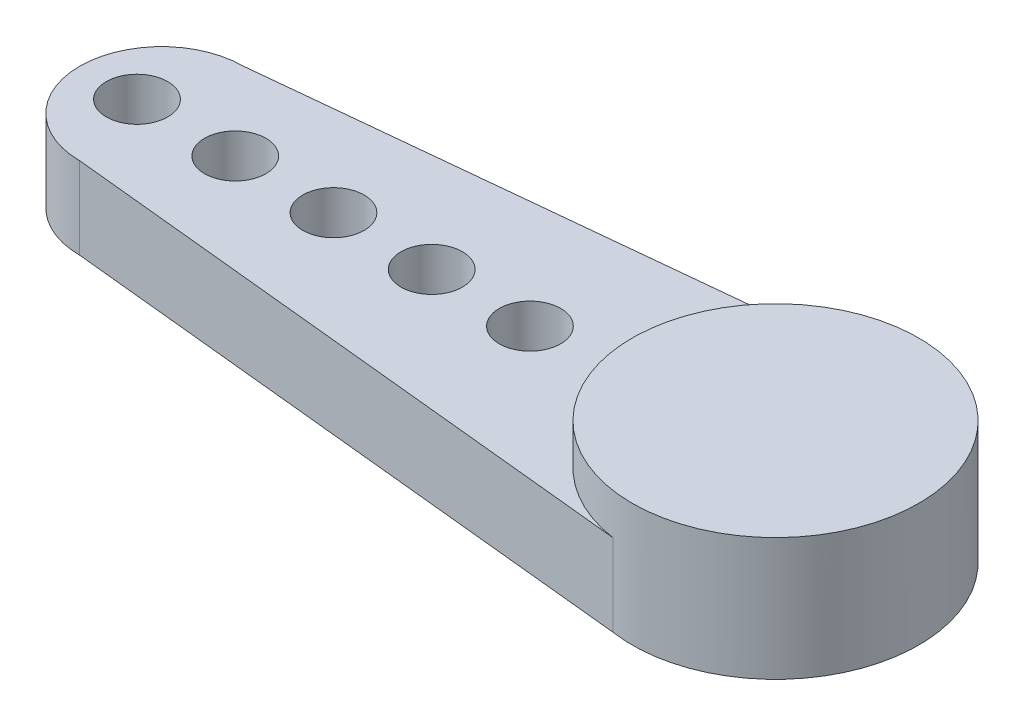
SolidWorks part; units mm, degrees
ref_plane "Front Plane" through (0, 0, 0) normal (0, 0, 1) x (1, 0, 0)
ref_plane "Top Plane" through (0, 0, 0) normal (0, 1, 0) x (1, 0, 0)
ref_plane "Right Plane" through (0, 0, 0) normal (1, 0, 0) x (0, 0, -1)
sketch "Sketch1" plane through (0, 0, 0) normal (0, 1, 0) x (1, 0, 0)
  line L0 (-15, 2) -> (-0.5089, 3.4628)
  line L1 (-15, -2) -> (-0.5089, -3.4628)
  arc A0 (-0.5089, -3.4628) -> (-0.5089, 3.4628) centre (0, 0) ccw
  arc A1 (-15, 2) -> (-15, -2) centre (-15, 0) ccw
  circle A2 centre (-6, 0) radius 0.75
  circle A3 centre (-8.4, 0) radius 0.75
  circle A4 centre (-10.8, 0) radius 0.75
  circle A5 centre (-13.2, 0) radius 0.75
  circle A6 centre (-15.6, 0) radius 0.75
  point P17 (-17, 0)
  point P18 (-17, 0)
  dimension "D1" = 3.5
  dimension "D2" = 2
  dimension "D4" = 1.5
  dimension "D3" = 15
  dimension "D5" = 6
  dimension "D6" = 2.4
  dimension "D7" = 2.4
  dimension "D8" = 2.4
  dimension "D9" = 2.4
extrude "Boss-Extrude1" add sketch "Sketch1" along normal blind 2
sketch "Sketch2" plane through (0, 2, 0) normal (0, 1, 0) x (1, 0, 0)
  circle A0 centre (0, 0) radius 3.5
extrude "Boss-Extrude2" add sketch "Sketch2" along normal blind 1
